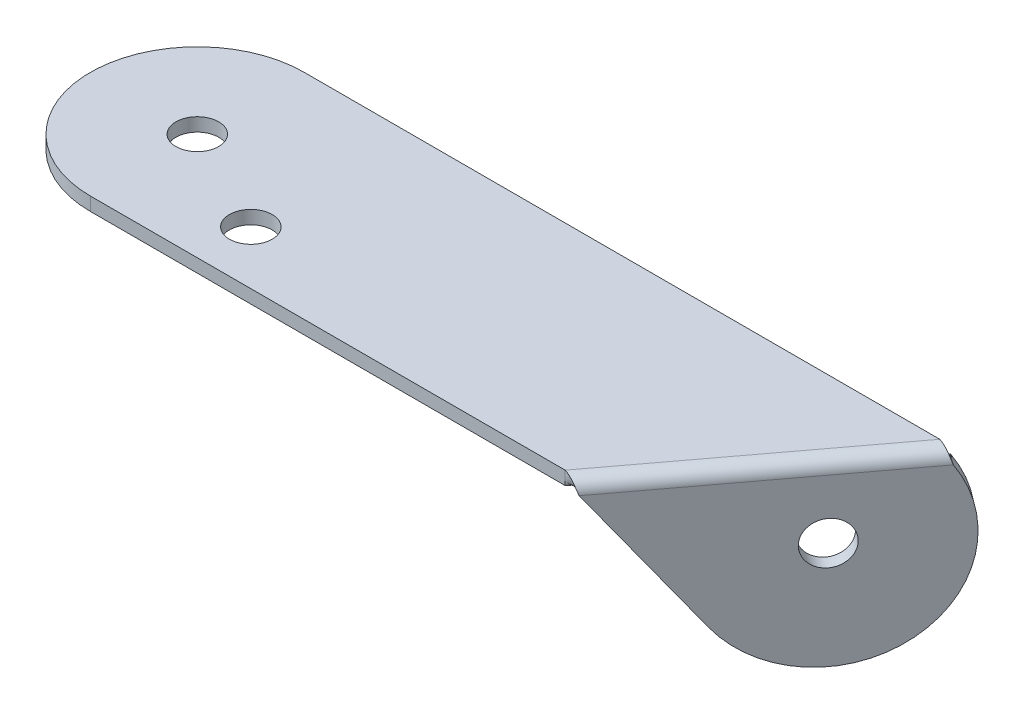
SolidWorks part; units mm, degrees
ref_plane "Front" through (0, 0, 0) normal (0, 0, 1) x (1, 0, 0)
ref_plane "Top" through (0, 0, 0) normal (0, 1, 0) x (1, 0, 0)
ref_plane "Right" through (0, 0, 0) normal (1, 0, 0) x (0, 0, -1)
sketch "Sketch1" plane through (0, 0, 0) normal (0, 1, 0) x (1, 0, 0)
  line L1 (48, 8) -> (0, 8)
  line L2 (0, -8) -> (48, -8)
  circle A0 centre (48, 0) radius 1.6
  circle A1 centre (0, 0) radius 1.6
  arc A2 (0, 8) -> (0, -8) centre (0, 0) ccw
  arc A3 (48, -8) -> (48, 8) centre (48, 0) ccw
  circle A4 centre (8, -4) radius 1.6
  dimension "D2" = 4
  dimension "D3" = 8
  dimension "D4" = 8
  dimension "D1" = 48
sheet metal parameters "Sheet-Metal1" thickness 1 parameters "D1"=0.01
base flange "Base-Flange1" sketch "Sketch1" thickness 1 reverse thickness direction yes parameters "D1"=0.01
sketch "Sketch3" plane through (0, 1, 0) normal (0, 1, 0) x (-1, 0, 0)
  line L2 (-36, 8) -> (-48, -8)
sketched bend "Sketched Bend1" parameters "D1"=0.01
bend "SketchBend1" bend radius 0.01 bend angle 90 parameters "D5"=1
flat pattern "Flat-Pattern1"
sketch "Bend-Lines1" plane through (0, 1, 0) normal (0, 1, 0) x (-1, 0, 0)
  line L0 (-48, -8) -> (-36, 8) construction
bend of the flat pattern "Flatten-<SketchBend1>1"
